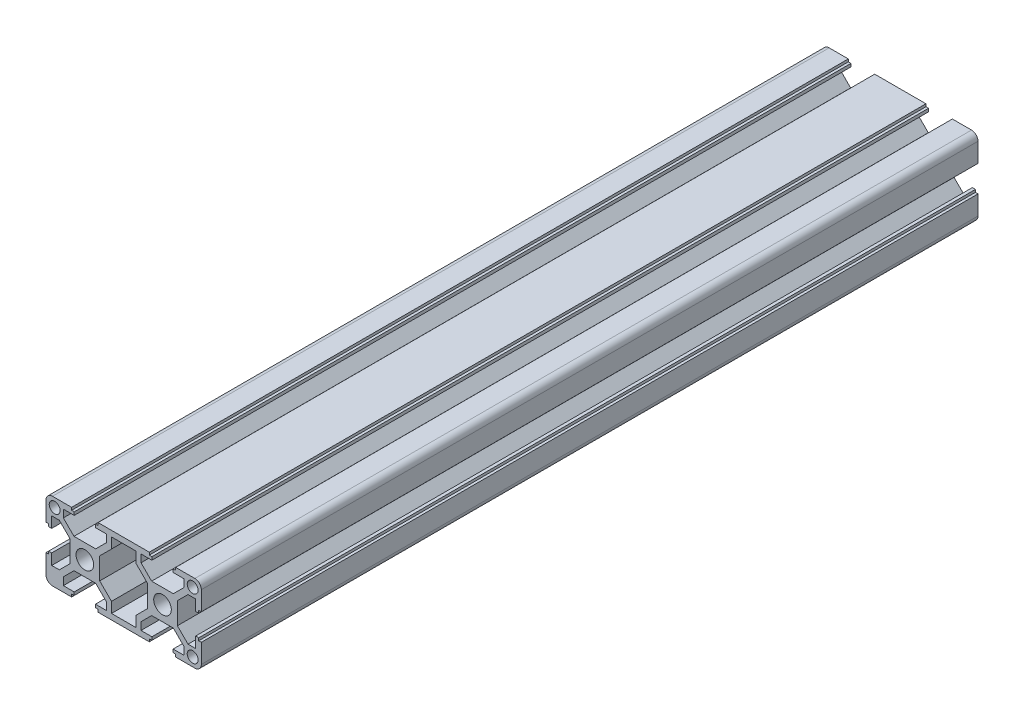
SolidWorks part; units mm, degrees
ref_plane "前视基准面" through (0, 0, 0) normal (0, 0, 1) x (1, 0, 0)
ref_plane "上视基准面" through (0, 0, 0) normal (0, 1, 0) x (1, 0, 0)
ref_plane "右视基准面" through (0, 0, 0) normal (1, 0, 0) x (0, 0, -1)
sketch "草图1"
sketch_block_instance "A$C158135D6-1"
sketch_block "A$C158135D6"
extrude "凸台-拉伸1" add sketch "草图1" along normal mid plane 300
